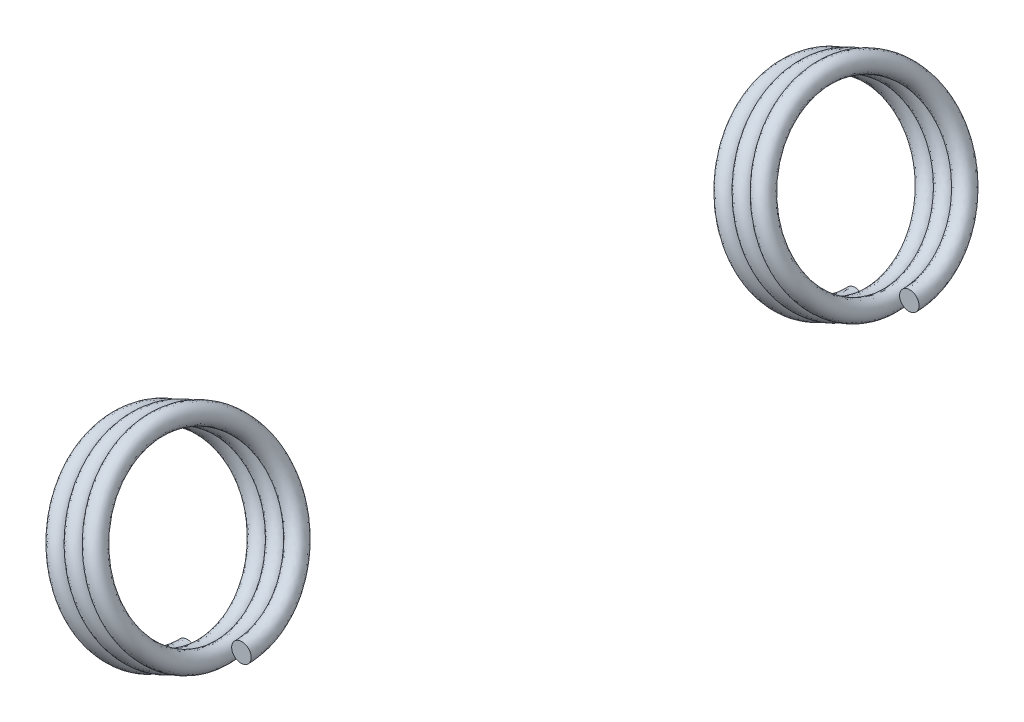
SolidWorks part; units mm, degrees
ref_plane "Alzado" through (0, 0, 0) normal (0, 0, 1) x (1, 0, 0)
ref_plane "Planta" through (0, 0, 0) normal (0, 1, 0) x (1, 0, 0)
ref_plane "Vista lateral" through (0, 0, 0) normal (1, 0, 0) x (0, 0, -1)
sketch3d "Sk_Plano_muelle_izq"
  point P0 (434.1303, 385.1286, 0)
  point P1 (434.1303, 385.1286, 10)
  point P2 (429.9206, 394.1993, 0)
ref_plane "Plano_muelle_izq" through (504.2575, 234.023, 0) normal (-0.9071, -0.421, 0) x (0, 0, 1)
sketch "Sk_muelle_izq" plane through (504.2575, 234.023, 0) normal (-0.9071, -0.421, 0) x (0, 0, 1)
  circle A0 centre (-26, 166.5855) radius 7.5
  dimension "DIAM1" = 15
curve "Helice_izq"
sweep "Muelle_izq" add path "Helice_izq" parameters "D3"=1.6
sketch3d "Sk_Plano_muelle_dcho"
  point P0 (434.1303, 385.1286, 0)
  point P1 (434.1303, 385.1286, 10)
  point P2 (429.9206, 394.1993, 0)
ref_plane "Plano_muelle_dcho" through (504.2575, 234.023, 0) normal (-0.9071, -0.421, 0) x (0, 0, 1)
sketch "Sk_muelle_dcho" plane through (504.2575, 234.023, 0) normal (-0.9071, -0.421, 0) x (0, 0, 1)
  circle A0 centre (26, 166.5855) radius 7.5
  dimension "DIAM2" = 15
curve "Helice_dcho"
sweep "Muelle_dcho" add path "Helice_dcho" parameters "D3"=1.6
